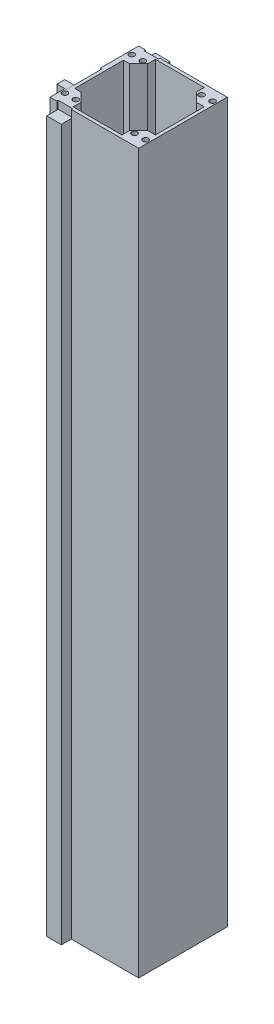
SolidWorks part; units mm, degrees
ref_plane "Ebene vorne" through (0, 0, 0) normal (0, 0, 1) x (1, 0, 0)
ref_plane "Ebene oben" through (0, 0, 0) normal (0, 1, 0) x (1, 0, 0)
ref_plane "Ebene rechts" through (0, 0, 0) normal (1, 0, 0) x (0, 0, -1)
sketch "Skizze1" plane through (0, 0, 0) normal (0, 1, 0) x (1, 0, 0)
  line L0 (-58.5, -112.5) -> (112.5, -112.5)
  line L1 (-112.5, 112.5) -> (-95.5, 112.5)
  line L2 (-112.5, 112.5) -> (-112.5, 15)
  line L3 (-112.5, -112.5) -> (-95.5, -112.5)
  line L4 (112.5, 112.5) -> (112.5, -112.5)
  line L5 (-112.5, 112.5) -> (112.5, -112.5) construction
  line L6 (-112.5, -112.5) -> (112.5, 112.5) construction
  line L8 (-95.5, 112.5) -> (-95.5, 109)
  line L9 (-95.5, 109) -> (-58.5, 109)
  line L10 (-58.5, 112.5) -> (-58.5, 109)
  line L11 (-58.5, 112.5) -> (112.5, 112.5)
  line L12 (-95.5, -112.5) -> (-95.5, -109)
  line L13 (-95.5, -109) -> (-58.5, -109)
  line L14 (-58.5, -112.5) -> (-58.5, -109)
  line L18 (-62, 104.5) -> (62, 104.5)
  line L19 (62, 104.5) -> (62, 85)
  line L20 (85, 62) -> (104.5, 62)
  line L21 (104.5, 62) -> (104.5, -62)
  line L22 (104.5, -62) -> (85, -62)
  line L23 (62, -85) -> (62, -104.5)
  line L24 (62, -104.5) -> (-62, -104.5)
  line L25 (-62, -104.5) -> (-62, -85)
  line L26 (-85, -62) -> (-100.5, -62)
  line L27 (-100.5, -62) -> (-100.5, 62)
  line L28 (-100.5, 62) -> (-85, 62)
  line L29 (-62, 85) -> (-62, 104.5)
  line L30 (-62, 85) -> (-85, 62)
  line L31 (62, 85) -> (85, 62)
  line L32 (85, -62) -> (62, -85)
  line L33 (-62, -85) -> (-85, -62)
  line L34 (-108.5, 15) -> (-112.5, 15)
  line L35 (-108.5, 15) -> (-108.5, -75)
  line L36 (-108.5, -75) -> (-112.5, -75)
  line L37 (-112.5, -75) -> (-112.5, -112.5)
  point P0 (0, 0)
  dimension "D1" = 225
  dimension "D2" = 225
  dimension "D3" = 37.5
  dimension "D4" = 4
  dimension "D5" = 90
  dimension "D6" = 13
  dimension "D7" = 37
  dimension "D8" = 3.5
extrude "Aufsatz-Linear austragen1" add sketch "Skizze1" along normal blind 1825
sketch "Skizze2" plane through (0, 0, 0) normal (0, 1, 0) x (1, 0, 0)
  line L0 (-58.5, 109) -> (-95.5, 109) construction
  line L1 (-95.5, 138) -> (-58.5, 138)
  line L2 (-95.5, 138) -> (-95.5, 109)
  line L3 (-95.5, 109) -> (-58.5, 109)
  line L4 (-58.5, 138) -> (-58.5, 109)
  line L5 (-58.5, -138) -> (-95.5, -138)
  line L6 (-58.5, -138) -> (-58.5, -109)
  line L7 (-58.5, -109) -> (-95.5, -109)
  line L8 (-95.5, -138) -> (-95.5, -109)
  line L9 (-95.5, -109) -> (-58.5, -109) construction
  dimension "D1" = 37
  dimension "D2" = 29
extrude "Aufsatz-Linear austragen2" add sketch "Skizze2" along normal up to surface (1825 mm away) separate body
sketch "Skizze3" plane through (0, 0, 0) normal (0, 1, 0) x (1, 0, 0)
  line L1 (-132.5, -75) -> (-108.5, -75)
  line L2 (-132.5, -75) -> (-132.5, -55.5)
  line L3 (-132.5, -55.5) -> (-108.5, -55.5)
  line L4 (-108.5, -75) -> (-108.5, -55.5)
  dimension "D1" = 24
  dimension "D2" = 19.5
extrude "Aufsatz-Linear austragen3" add sketch "Skizze3" along normal up to surface (1705 mm away) from offset 120 separate body
sketch "Skizze4" plane through (0, 1825, 0) normal (0, 1, 0) x (1, 0, 0)
  line L0 (-112.5, -112.5) -> (-95.5, -112.5) construction
  line L1 (92, 179) -> (12, 179)
  line L2 (92, 179) -> (92, 112.5)
  line L3 (92, 112.5) -> (12, 112.5)
  line L4 (12, 179) -> (12, 112.5)
  line L5 (92, -179) -> (12, -179)
  line L6 (92, -179) -> (92, -112.5)
  line L7 (92, -112.5) -> (12, -112.5)
  line L8 (12, -179) -> (12, -112.5)
sketch "Skizze6" plane through (112.5, 0, 0) normal (1, 0, 0) x (0, 0, -1)
  line L0 (-112.5, 0) -> (112.5, 0) construction
  line L1 (-40, 340) -> (40, 340)
  line L2 (-70, 310) -> (-70, 70)
  line L3 (-40, 40) -> (40, 40)
  line L4 (70, 310) -> (70, 70)
  line L5 (0, 40) -> (0, 0) construction
  arc A0 (-70, 70) -> (-40, 40) centre (-40, 70) ccw
  arc A1 (40, 40) -> (70, 70) centre (40, 70) ccw
  arc A2 (70, 310) -> (40, 340) centre (40, 310) ccw
  arc A3 (-40, 340) -> (-70, 310) centre (-40, 310) ccw
  dimension "D4" = 30
  dimension "D1" = 40
  dimension "D2" = 300
  dimension "D3" = 140
sketch "Skizze7" plane through (0, 0, 0) normal (0, 1, 0) x (1, 0, 0)
  line L1 (-148.5, 105) -> (-112.5, 105)
  line L2 (-148.5, 105) -> (-148.5, 65)
  line L3 (-148.5, 65) -> (-112.5, 65)
  line L4 (-112.5, 105) -> (-112.5, 65)
  line L5 (-112.5, 112.5) -> (-112.5, 15) construction
extrude "Aufsatz-Linear austragen6" add sketch "Skizze7" along normal blind 100 from offset 177 separate body
sketch "Skizze8" plane through (0, 277, 0) normal (0, 1, 0) x (1, 0, 0)
  circle A0 centre (-130.5, 85) radius 17.5
extrude "Aufsatz-Linear austragen7" add sketch "Skizze8" along normal blind 40 separate body
sketch "Skizze13" plane through (-112.5, 0, 0) normal (-1, 0, 0) x (0, 0, 1)
  line L1 (-90, 117.5) -> (-50, 117.5)
  line L2 (-90, 117.5) -> (-90, 257.5)
  line L3 (-90, 257.5) -> (-50, 257.5)
  line L4 (-50, 117.5) -> (-50, 257.5)
  line L5 (-90, 1675.5) -> (-50, 1675.5)
  line L6 (-90, 1675.5) -> (-90, 1535.5)
  line L7 (-90, 1535.5) -> (-50, 1535.5)
  line L8 (-50, 1675.5) -> (-50, 1535.5)
  dimension "D1" = 140
  dimension "D2" = 40
  dimension "D3" = 117.5
  dimension "D4" = 22.5
  dimension "D5" = 1278
extrude "Aufsatz-Linear austragen8" add sketch "Skizze13" along normal blind 40
sketch "Skizze14" plane through (0, 257.5, 0) normal (0, 1, 0) x (1, 0, 0)
  circle A0 centre (-132.9073, 69.9069) radius 14
extrude "Aufsatz-Linear austragen9" add sketch "Skizze14" along normal blind 114
sketch "Skizze15" plane through (0, 1535.5, 0) normal (0, -1, 0) x (1, 0, 0)
  circle A0 centre (-133.104, -70.4797) radius 14
extrude "Aufsatz-Linear austragen10" add sketch "Skizze15" along normal blind 114
sketch "Skizze23" plane through (0, 1825, 0) normal (0, 1, 0) x (1, 0, 0)
  line L0 (112.5, -112.5) -> (112.5, 112.5) construction
  line L5 (-102.5, -85) -> (102.5, -85)
  line L6 (-102.5, -85) -> (-102.5, 85)
  line L7 (-102.5, 85) -> (102.5, 85)
  line L8 (102.5, -85) -> (102.5, 85)
  line L9 (0, 85) -> (0, -85) construction
  line L10 (-102.5, 0) -> (102.5, 0) construction
  line L11 (112.5, 112.5) -> (-58.5, 112.5) construction
  point P0 (0, 0)
  point P8 (74.5, 85)
  point P9 (102.5, 85)
  point P10 (-74.5, 85)
  point P11 (-102.5, 85)
  point P12 (-74.5, -85)
  point P13 (-102.5, -85)
  point P14 (74.5, -85)
  point P16 (102.5, -85)
  dimension "D1" = 10
  dimension "D2" = 27.5
  dimension "D3" = 28
  dimension "D4" = 28
hole_wizard "M16 Gewindebohrung2" positions "Skizze24" profile "Skizze25" tap size "M16" standard "ISO"
sketch "Skizze24" plane through (0, 1825, 0) normal (0, 1, 0) x (1, 0, 0)
  point P2 (-102.5, 85)
  point P5 (-74.5, 85)
  point P8 (74.5, 85)
  point P11 (102.5, 85)
  point P14 (102.5, -85)
  point P17 (74.5, -85)
  point P20 (-74.5, -85)
  point P23 (-102.5, -85)
sketch "Skizze25" plane through (-102.5, 1825, -85) normal (1, 0, 0) x (0, 0, 1)
  line L0 (0, 0) -> (0, 46.206)
  line L1 (0, 46.206) -> (7, 42)
  line L2 (7, 42) -> (7, 0)
  line L5 (7, 0) -> (0, 0)
  line L10 (0, 46.206) -> (-7, 42) construction
  line L11 (0, -6.35) -> (0, 107.95) construction
  dimension "Bohrerdurchmesser" = 14
  dimension "Bohrungstiefe" = 42
  dimension "Spitzenwinkel" = 118
sketch "Skizze26" plane through (0, 1825, 0) normal (0, 1, 0) x (1, 0, 0)
  line L4 (-95.5, -138) -> (-58.5, -138)
  line L5 (-58.5, -138) -> (-58.5, -109)
  line L6 (-58.5, -109) -> (-95.5, -109)
  line L7 (-95.5, -109) -> (-95.5, -138)
  line L8 (-95.5, -138) -> (-58.5, -138)
  line L9 (-58.5, -138) -> (-58.5, -109)
  line L10 (-58.5, -109) -> (-95.5, -109)
  line L11 (-95.5, -109) -> (-95.5, -138)
  line L12 (-58.5, 138) -> (-95.5, 138)
  line L13 (-95.5, 138) -> (-95.5, 109)
  line L14 (-95.5, 109) -> (-58.5, 109)
  line L15 (-58.5, 109) -> (-58.5, 138)
  line L16 (-58.5, 138) -> (-95.5, 138)
  line L17 (-95.5, 138) -> (-95.5, 109)
  line L18 (-95.5, 109) -> (-58.5, 109)
  line L19 (-58.5, 109) -> (-58.5, 138)
  dimension "D1" = 0
  dimension "D2" = 0
extrude "Schnitt-Linear austragen1" cut sketch "Skizze26" against normal blind 20
